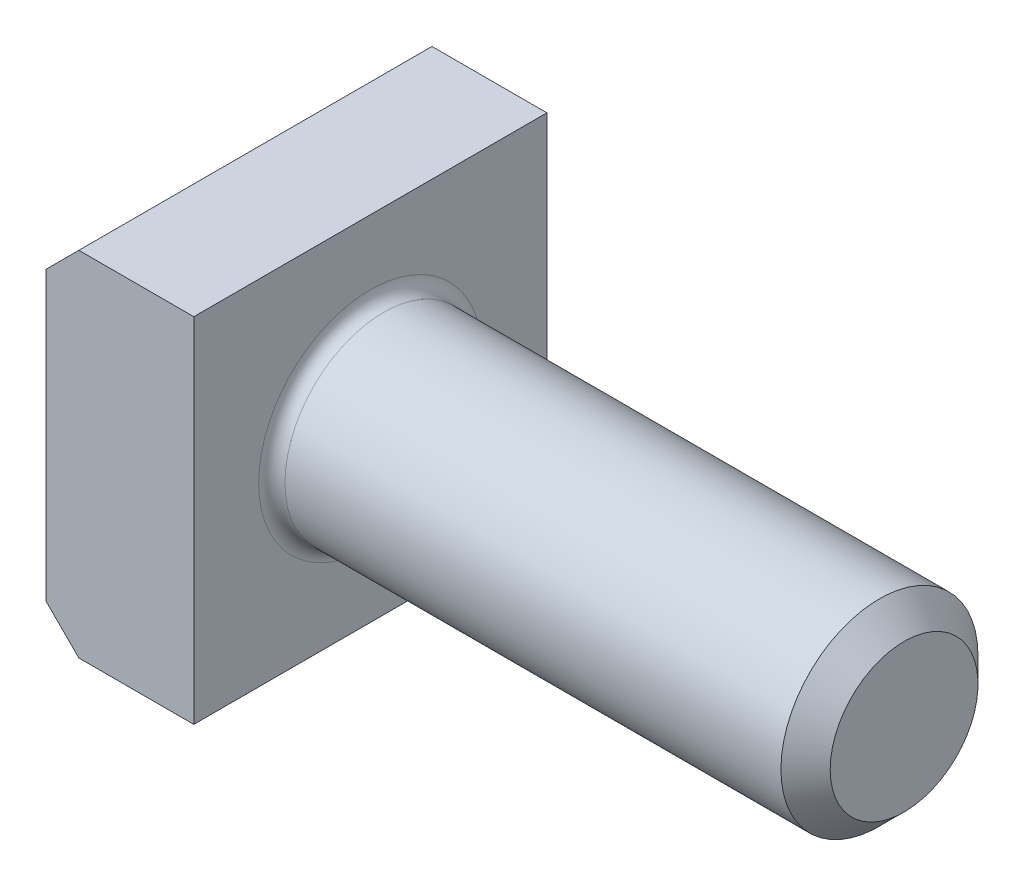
SolidWorks part; units mm, degrees
ref_plane "Front Plane" through (0, 0, 0) normal (0, 0, 1) x (1, 0, 0)
ref_plane "Top Plane" through (0, 0, 0) normal (0, 1, 0) x (1, 0, 0)
ref_plane "Right Plane" through (0, 0, 0) normal (1, 0, 0) x (0, 0, -1)
sketch "BaseBodySke" plane through (0, 0, 0) normal (0, 0, 1) x (1, 0, 0)
  line L0 (-107.4075, 0) -> (214.0904, 0) construction
  line L1 (0, 0) -> (0, 12)
  line L4 (0, 12) -> (65, 12)
  line L5 (65, 12) -> (65, 0)
  line L6 (65, 0) -> (0, 0)
  line L7 (35, 10) -> (35, -17.9005) construction
  line L8 (34.0602, 10.352) -> (57.5082, 10.352) construction
  line L9 (62, 13.8049) -> (62, -14.5195) construction
  dimension "Diameter" = 24
  dimension "Length" = 65
  dimension "Thread_length" = 30
  dimension "Minor_dia" = 20.704
  dimension "Advance" = 3
revolve "BaseBody" add sketch "BaseBodySke" angle 360 about L6
sketch "HeadSke" plane through (0, 0, 0) normal (0, 0, 1) x (1, 0, 0)
  line L0 (0, 0) -> (-36.296, 0) construction
  line L1 (-14, 21.5) -> (0, 21.5)
  line L2 (-18, 17.5) -> (-18, -17.5)
  line L3 (-14, -21.5) -> (0, -21.5)
  line L4 (0, 21.5) -> (0, -21.5)
  line L5 (-18, 17.5) -> (-14, 21.5)
  line L6 (-18, -17.5) -> (-14, -21.5)
  point P10 (-18, 0)
  dimension "Head_width" = 43
  dimension "Head_height" = 18
  dimension "Head_Chamfer" = 4
  dimension "Ang" = 45
extrude "Head" add sketch "HeadSke" along normal mid plane 43
sketch "FlatEndSke" plane through (0, 0, 0) normal (0, 0, 1) x (1, 0, 0)
  line L0 (62, 12) -> (65, 12)
  line L1 (65, 12) -> (65, 9)
  line L2 (65, 9) -> (62, 12)
  line L3 (65, -12) -> (65, 12) construction
  line L5 (0, 0) -> (89.7899, 0) construction
  line L7 (65, 12) -> (0, 12) construction
  dimension "D1" = 45
  dimension "Chamfer_width" = 3
revolve "FlatEnd" cut sketch "FlatEndSke" angle 360 about L5
sketch "CutEndSke" plane through (65, 0, 0) normal (1, 0, 0) x (0, 0, -1)
  circle A0 centre (0, 0) radius 12 construction
  circle A1 centre (0, 0) radius 12
extrude "CutEnd" [suppressed] cut sketch "CutEndSke" against normal blind 3
dome "RoundEnd" [suppressed] faces to dome 1 distance 3 parameters "D1"=3
fillet "Fillet" radius 1.6 1 edges at (0, 0, 12)
sketch "ThdSchSke" plane through (0, 0, 0) normal (0, 0, 1) x (1, 0, 0)
  line L0 (0, 0) -> (89.8666, 0) construction
  line L1 (65, -27.1828) -> (65, 30.5493) construction
  line L2 (59.6, 10.352) -> (58.6485, 12)
  line L3 (58.6485, 12) -> (58.6485, 13.9029)
  line L4 (58.6485, 13.9029) -> (60.5515, 13.9029)
  line L5 (60.5515, 13.9029) -> (60.5515, 12)
  line L6 (60.5515, 12) -> (59.6, 10.352)
  dimension "D1" = 20.704
  dimension "Length" = 65
  dimension "Advance" = 5.4
  dimension "D2" = 24
revolve "ThreadSchematic" [suppressed] cut sketch "ThdSchSke" angle 360 about L0
pattern_linear "ThdSchPat" [suppressed] count 10 spacing 3 along (1, 0, 0)
equation "\"Thread_minor@ThreadCosmetic\" = \"Minor_dia@BaseBodySke\""
equation "\"Thread_length@ThreadCosmetic\" = \"Thread_length@BaseBodySke\""
equation "\"D1@Head\" = \"Head_width@HeadSke\""
equation "\"D1@CutEnd\" = \"Chamfer_width@FlatEndSke\""
equation "\"D1@RoundEnd\" = \"Chamfer_width@FlatEndSke\""
equation "\"Length@ThdSchSke\" = \"Length@BaseBodySke\""
equation "\"Advance@ThdSchSke\" = \"Advance@BaseBodySke\"*1.8"
equation "\"D2@ThdSchSke\" = \"Diameter@BaseBodySke\""
equation "\"D1@ThdSchSke\" = \"Minor_dia@BaseBodySke\""
equation "\"D3@ThdSchPat\" = \"Advance@BaseBodySke\""
equation "\"D1@ThdSchPat\" =  int( \"Thread_length@BaseBodySke\" / \"Advance@BaseBodySke\" ) "
